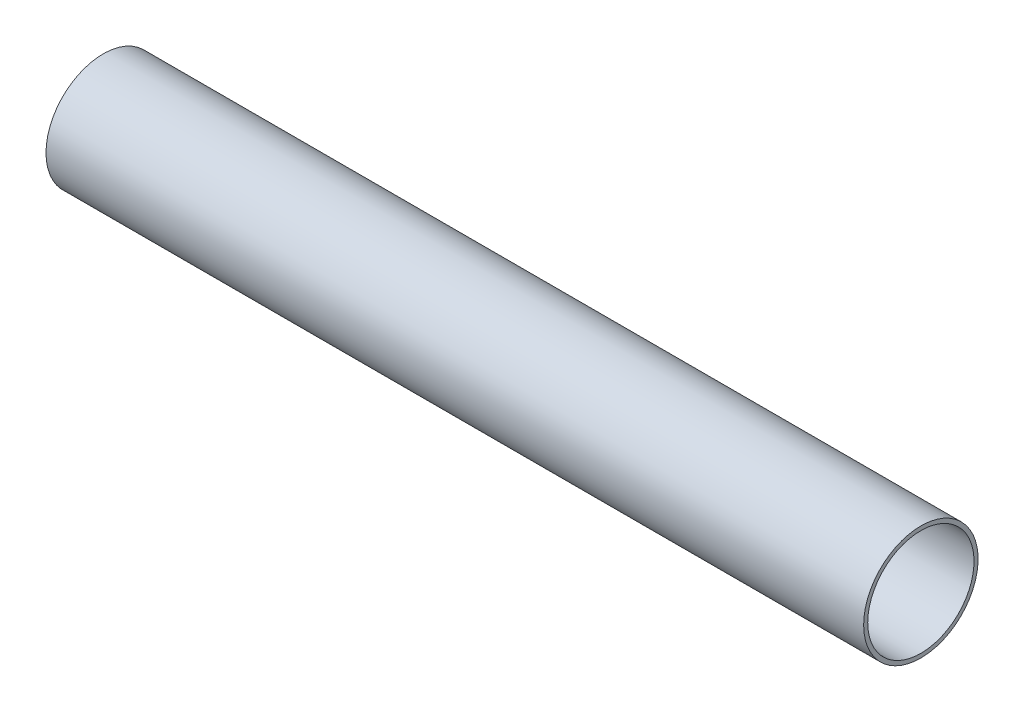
SolidWorks part; units mm, degrees
ref_plane "Plane1" through (0, 0, 0) normal (0, 0, 1) x (1, 0, 0)
ref_plane "Plane2" through (0, 0, 0) normal (0, 1, 0) x (1, 0, 0)
ref_plane "Plane3" through (0, 0, 0) normal (1, 0, 0) x (0, 0, -1)
sketch "Esquisse1" plane through (0, 0, 0) normal (0, 0, 1) x (1, 0, 0)
  line L0 (0, 0) -> (123.2563, 0) construction
  line L1 (0, 14) -> (200, 14)
  line L2 (0, 14) -> (0, 13)
  line L3 (200, 13) -> (0, 13)
  line L4 (200, 13) -> (200, 14)
  dimension "D1" = 1
  dimension "D2" = 200
  dimension "D3" = 13
revolve "Base-Révolution" add sketch "Esquisse1" angle 360 about L0
